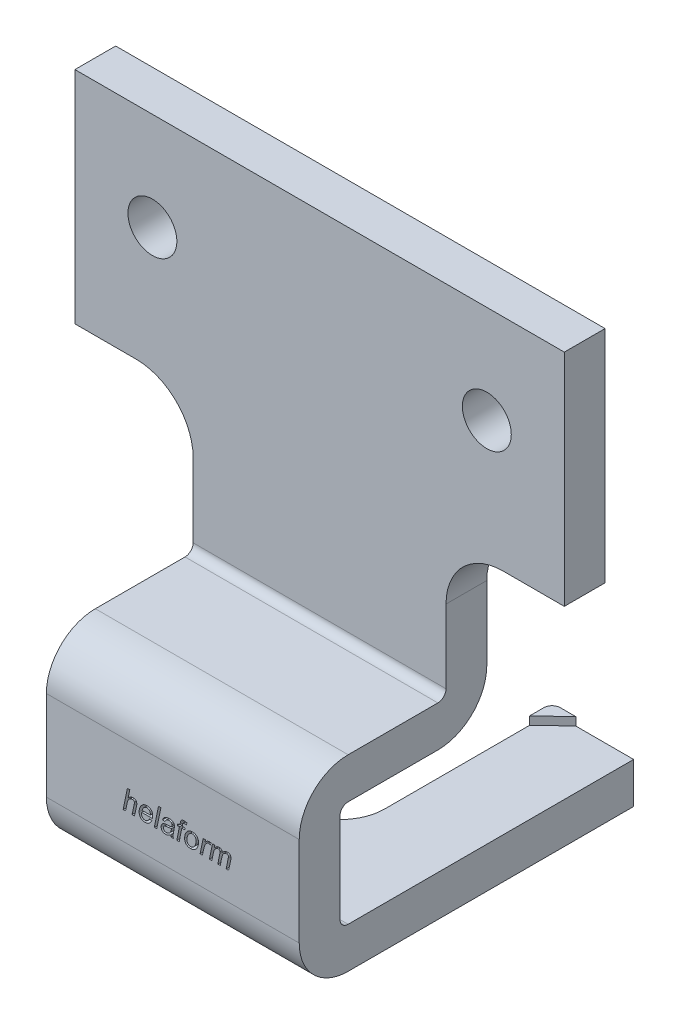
SolidWorks part; units mm, degrees
ref_plane "Front" through (0, 0, 0) normal (0, 0, 1) x (1, 0, 0)
ref_plane "Top" through (0, 0, 0) normal (0, 1, 0) x (1, 0, 0)
ref_plane "Right" through (0, 0, 0) normal (1, 0, 0) x (0, 0, -1)
sketch "Sketch1" plane through (0, 0, 0) normal (1, 0, 0) x (0, 0, -1)
  line L0 (0, 0) -> (0, -43)
  line L1 (-1, -44) -> (-12, -44)
  line L2 (-18, -50) -> (-18, -61)
  line L3 (-12, -67) -> (23, -67)
  line L4 (5, 0) -> (5, -43)
  line L5 (-1, -49) -> (-12, -49)
  line L6 (-13, -50) -> (-13, -61)
  line L7 (-12, -62) -> (23, -62)
  line L8 (0, 0) -> (5, 0)
  line L9 (23, -62) -> (23, -67)
  arc A0 (0, -43) -> (-1, -44) centre (-1, -43) cw
  arc A1 (-12, -44) -> (-18, -50) centre (-12, -50) ccw
  arc A2 (-18, -61) -> (-12, -67) centre (-12, -61) ccw
  arc A3 (5, -43) -> (-1, -49) centre (-1, -43) cw
  arc A4 (-12, -49) -> (-13, -50) centre (-12, -50) ccw
  arc A5 (-13, -61) -> (-12, -62) centre (-12, -61) ccw
  dimension "D2" = 6
  dimension "D3" = 18
  dimension "D6" = 1
  dimension "D1" = 67
  dimension "D4" = 41
  dimension "D5" = 23
  dimension "D7" = 5
extrude "Extrude1" add sketch "Sketch1" along normal blind 31
sketch "Sketch2" plane through (0, 0, -5) normal (0, 0, -1) x (-1, 0, 0)
  line L0 (-31, 0) -> (0, 0) construction
  line L1 (-15.5, 0) -> (-15.5, -43) construction
  line L2 (-31, -43) -> (0, -43) construction
  line L3 (-45.5, 0) -> (14.5, 0)
  line L4 (14.5, 0) -> (14.5, -27)
  line L5 (14.5, -27) -> (7, -27)
  line L6 (-45.5, -27) -> (-38, -27)
  line L7 (0, -43) -> (0, 0) construction
  line L8 (0, -34) -> (-31, -34)
  line L9 (-45.5, 0) -> (-45.5, -27)
  arc A0 (7, -27) -> (0, -34) centre (7, -34) ccw
  arc A1 (-38, -27) -> (-31, -34) centre (-38, -34) cw
  point P17 (-15.5, -34)
  dimension "D3" = 7
  dimension "D1" = 30
  dimension "D2" = 27
extrude "Extrude2" add sketch "Sketch2" against normal blind 5
sketch "Sketch3" plane through (0, 0, 0) normal (0, 0, 1) x (1, 0, 0)
  line L0 (45.5, 0) -> (-14.5, 0) construction
  line L1 (15.5, 0) -> (15.5, -43) construction
  line L2 (31, -43) -> (0, -43) construction
  circle A0 centre (-5, -12) radius 3
  circle A1 centre (36, -12) radius 3
  dimension "D1" = 6
  dimension "D3" = 41
  dimension "D2" = 12
extrude "Extrude3" cut sketch "Sketch3" against normal through all
sketch "Sketch4" plane through (0, -67, 0) normal (0, -1, 0) x (1, 0, 0)
  line L0 (15.5, -23) -> (15.5, 12) construction
  line L1 (31, -23) -> (0, -23) construction
  line L2 (31, 12) -> (0, 12) construction
  line L3 (10, -23) -> (10, -2.5)
  line L4 (21, -2.5) -> (21, -23)
  line L5 (10, -23) -> (21, -23)
  arc A0 (10, -2.5) -> (21, -2.5) centre (15.5, -2.5) cw
  dimension "D1" = 5.5
  dimension "D2" = 26
extrude "Extrude4" cut sketch "Sketch4" against normal up to next
fillet "Fillet2" radius 1 2 edges at (10, -64.5, -23) (21, -64.5, -23)
sketch "Sketch5" plane through (0, -62, 0) normal (0, 1, 0) x (1, 0, 0)
  line L0 (31, -12) -> (0, -12) construction
  line L1 (15.5, -12) -> (15.5, 23.8589) construction
  line L2 (23.9044, 23) -> (21, 20.2497)
  line L3 (31, 23) -> (22, 23) construction
  line L4 (7.0956, 23) -> (9, 23)
  line L5 (21, 2.5) -> (21, 22) construction
  line L6 (21, 20.2497) -> (21, 22)
  line L7 (23.9044, 23) -> (22, 23)
  line L8 (10, 20.2497) -> (10, 22)
  line L9 (7.0956, 23) -> (10, 20.2497)
  arc A0 (22, 23) -> (21, 22) centre (22, 22) ccw construction
  arc A1 (22, 23) -> (21, 22) centre (22, 22) ccw
  arc A2 (9, 23) -> (10, 22) centre (9, 22) cw
  dimension "D1" = 4
  dimension "D2" = 1.9044
extrude "Extrude5" add sketch "Sketch5" along normal blind 1
sketch "Sketch6" plane through (0, 0, 18) normal (0, 0, 1) x (1, 0, 0)
  line L0 (0, -55.5) -> (31, -55.5) construction
  line L3 (15.5, -50) -> (15.5, -61) construction
  line L6 (31, -50) -> (0, -50) construction
  line L7 (31, -61) -> (0, -61) construction
  line L8 (0, -50) -> (0, -61) construction
  line L9 (31, -50) -> (31, -61) construction
  text T0 "helaform" font "Arial" height 2.5
extrude "Cut-Extrude1" cut sketch "Sketch6" against normal blind 1
